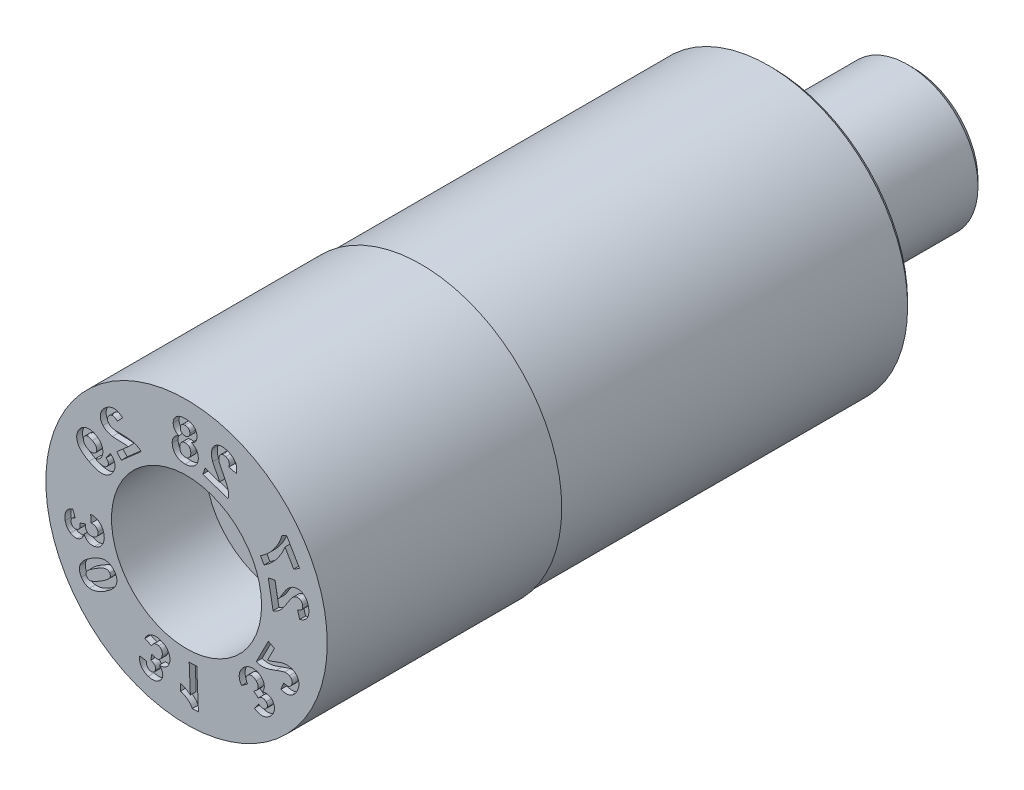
SolidWorks part; units mm, degrees
other "<M6 X 1 SHSS>-<Revolve1>"
ref_plane "Front Plane" through (0, 0, 0) normal (0, 0, 1) x (1, 0, 0)
ref_plane "Top Plane" through (0, 0, 0) normal (0, 1, 0) x (1, 0, 0)
ref_plane "Right Plane" through (0, 0, 0) normal (1, 0, 0) x (0, 0, -1)
sketch "Sketch1" plane through (0, 0, 0) normal (1, 0, 0) x (0, 0, -1)
  line L2 (0, 6) -> (0, 3.2)
  line L3 (24.75, 6) -> (0, 6)
  line L4 (-3.7979, 0) -> (49996.2021, 0) construction
  line L8 (19, 1.5) -> (4, 1.5)
  line L9 (4, 3.2) -> (4, 1.5)
  line L10 (4, 3.2) -> (0, 3.2)
  line L12 (25, 3) -> (25, 5.75)
  line L16 (25, 5.75) -> (24.75, 6)
  line L17 (25, 3) -> (19, 3)
  line L18 (19, 1.5) -> (19, 3)
  dimension "D1" = 25
  dimension "D2" = 45
  dimension "D3" = 0.25
  dimension "D4" = 12
  dimension "D5" = 6.4
  dimension "D6" = 4
  dimension "D7" = 3
  dimension "D8" = 6
  dimension "D9" = 6
revolve "Revolve1" add sketch "Sketch1" angle 360 about L4
sketch "Sketch4" plane through (0, 0, 0) normal (1, 0, 0) x (0, 0, -1)
  line L0 (0, 0) -> (50000, 0) construction
  line L1 (25, -5.75) -> (25, 5.75) construction
  line L2 (10, 6.935) -> (25, 6.935)
  line L3 (10, 6.935) -> (10, 5.935)
  line L4 (10, 5.935) -> (25, 5.935)
  line L5 (25, 6.935) -> (25, 5.935)
  line L6 (24.75, 6) -> (0, 6) construction
  line L9 (0, 6.6) -> (0, -6.6) construction
  dimension "D1" = 1
  dimension "D2" = 0.065
  dimension "D3" = 10
revolve "Cut-Revolve1" cut sketch "Sketch4" angle 360 about L0
sketch "Sketch2" plane through (0, 0, 0) normal (0, 0, 1) x (1, 0, 0)
  line L0 (0, 0) -> (0, 7.0261) construction
  line L1 (0, 0) -> (6.0848, 3.513) construction
  line L2 (0, 0) -> (6.0848, -3.513) construction
  line L3 (0, 0) -> (0, -7.0261) construction
  line L4 (0, 0) -> (-6.0848, -3.513) construction
  line L5 (0, 0) -> (-6.0848, 3.513) construction
  circle A0 centre (0.0094, -0.0094) radius 3.6901 construction
  text T0 "27  28  29  30  31  32" font "Arial" height 1.66
  point P11 (0, 0)
  point P161 (0, 0)
  point P162 (0.0094, 0)
  point P163 (0.0094, -0.0094)
  dimension "D1" = 6
extrude "Cut-Extrude1" cut sketch "Sketch2" against normal blind 0.25
sketch "Sketch3" plane through (0, 0, -4) normal (0, 0, 1) x (1, 0, 0)
  line L0 (0, 0) -> (0, 50000) construction
  line L1 (0.866, 1.5) -> (-0.866, 1.5)
  line L2 (-0.866, 1.5) -> (-1.7321, 0)
  line L3 (-1.7321, 0) -> (-0.866, -1.5)
  line L4 (-0.866, -1.5) -> (0.866, -1.5)
  line L5 (0.866, -1.5) -> (1.7321, 0)
  line L6 (1.7321, 0) -> (0.866, 1.5)
  line L7 (0, 0) -> (50000, 0) construction
  circle A0 centre (0, 0) radius 1.5 construction
  circle A1 centre (0, 0) radius 1.5 construction
extrude "Cut-Extrude2" cut sketch "Sketch3" against normal blind 3
inserted part "M6 X 1 SHSS"
move or copy body "Body-Move/Copy2" placed by mates yes
